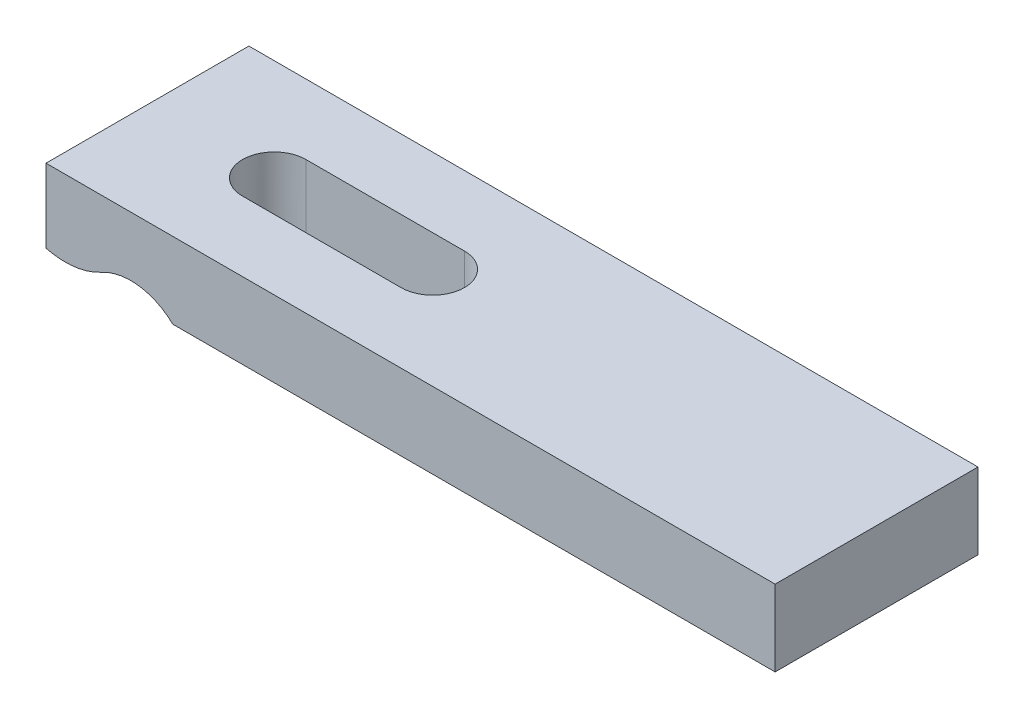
SolidWorks part; units mm, degrees
ref_plane "Plan1" through (0, 0, 0) normal (0, 0, 1) x (1, 0, 0)
ref_plane "Plan2" through (0, 0, 0) normal (0, 1, 0) x (1, 0, 0)
ref_plane "Plan3" through (0, 0, 0) normal (1, 0, 0) x (0, 0, -1)
sketch "Esquisse1" plane through (0, 0, 0) normal (0, 0, 1) x (1, 0, 0)
  line L0 (0, 0) -> (115, 0)
  line L1 (115, 0) -> (115, -12)
  line L2 (19.9964, -12) -> (115, -12)
  line L5 (0, 0) -> (0, -11.619)
  arc A0 (8.7617, -10.5263) -> (19.9964, -12) centre (13.3711, -18.9473) cw
  arc A1 (0, -11.619) -> (8.7617, -10.5263) centre (3, 0) ccw
  dimension "D2" = 115
  dimension "E" = 12
  dimension "D5" = 9.6
  dimension "D1" = 20
  dimension "D4" = 3
extrude "Base-Extrusion" add sketch "Esquisse1" along normal blind 32
sketch "Esquisse2" plane through (0, 0, 0) normal (0, 1, 0) x (1, 0, 0)
  line L0 (-9.5, -16) -> (57, -16) construction
  line L1 (115, 0) -> (0, 0) construction
  line L2 (20, 3.5) -> (20, -20) construction
  line L3 (45, 3.5) -> (45, -20) construction
  line L4 (20, -11) -> (45, -11)
  line L5 (20, -21) -> (45, -21)
  arc A0 (20, -11) -> (20, -21) centre (20, -16) ccw
  arc A1 (45, -21) -> (45, -11) centre (45, -16) ccw
  dimension "D1" = 16
  dimension "D3" = 10
  dimension "D4" = 45
  dimension "D5" = 25
extrude "Enlèv. mat.-Extru.1" cut sketch "Esquisse2" against normal through all
ref_plane "Plan4" through (0, 10, 0) normal (0, 1, 0) x (-1, 0, 0)
ref_plane "Plan5" through (115, 0, 0) normal (1, 0, 0) x (0, 0, -1)
equation "\"D5@Esquisse1\" = \"E@Esquisse1\"*.8"
equation "\"D1@Esquisse2\"=\"D1@Base-Extrusion\"/2"
